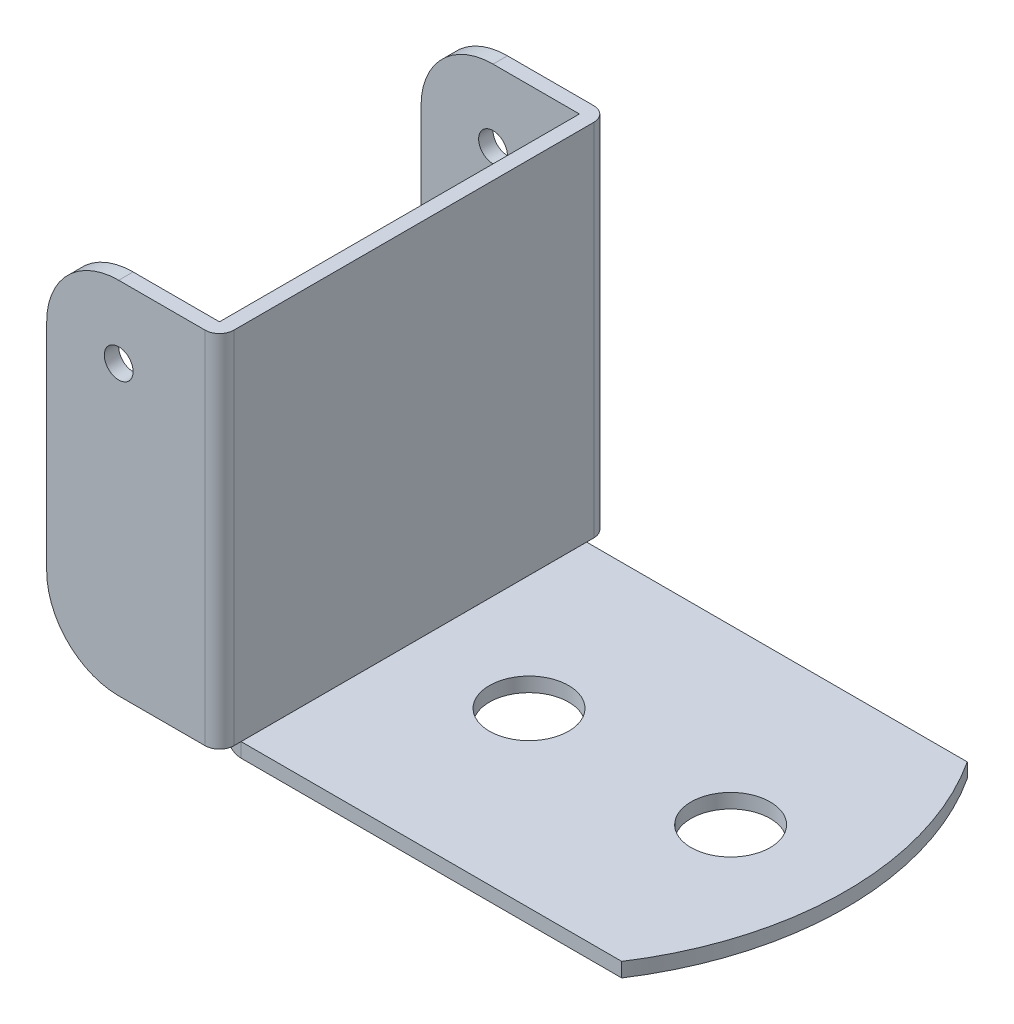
SolidWorks part; units mm, degrees
ref_plane "Front Plane" through (0, 0, 0) normal (0, 0, 1) x (1, 0, 0)
ref_plane "Top Plane" through (0, 0, 0) normal (0, 1, 0) x (1, 0, 0)
ref_plane "Right Plane" through (0, 0, 0) normal (1, 0, 0) x (0, 0, -1)
sketch "Sketch1" plane through (0, 0, 0) normal (0, 1, 0) x (1, 0, 0)
  line L0 (0, 0) -> (0, 24) construction
  line L1 (0, 0) -> (26.4391, 0)
  line L2 (0, 24) -> (26.4391, 24)
  line L3 (0, 12) -> (30, 12) construction
  line L4 (-25, 0) -> (-25, 24)
  line L5 (0, 24) -> (-25, 24)
  line L6 (0, 0) -> (-25, 0)
  circle A0 centre (8, 12) radius 2.75
  circle A1 centre (22, 12) radius 2.75
  arc A2 (26.4391, 0) -> (26.4391, 24) centre (8, 12) ccw
  point P17 (-25, 36)
  dimension "D1" = 5.5
  dimension "D2" = 22
  dimension "D3" = 14
  dimension "D4" = 8
  dimension "D5" = 24
  dimension "D7" = 12
  dimension "D6" = 25
sheet metal parameters "Sheet-Metal1" thickness 1 parameters "D1"=0.0001
base flange "Base-Flange1" sketch "Sketch1" thickness 1 reverse thickness direction yes parameters "D1"=0.0001
sketch "Sketch3" plane through (0, 1, 0) normal (0, 1, 0) x (1, 0, 0)
  line L1 (0, 0) -> (0, 24)
  line L2 (26.4391, 24) -> (-25, 24) construction
sketched bend "Sketched Bend16" parameters "D1"=0.001
bend "SketchBend39" bend radius 0.001 bend angle 90 parameters "D5"=1
ref_plane "Plane1" through (0, 0, -12) normal (0, 0, 1) x (1, 0, 0)
sketch "Sketch7" plane through (0, 0, 0) normal (0, 0, 1) x (1, 0, 0)
  line L1 (0, 26.0004) -> (-1, 26.0004)
  line L2 (0, 26.0004) -> (0, 1.0004)
  line L3 (0, 1.0004) -> (-1, 1.0004)
  line L4 (-1, 26.0004) -> (-1, 1.0004)
  dimension "D1" = 1
  dimension "D2" = 25
extrude "Extrude2" add sketch "Sketch7" along normal blind 0.5
sketch "Sketch8" plane through (0, 0, 0.5) normal (0, 0, 1) x (1, 0, 0)
  line L1 (0, 26.0004) -> (-7, 26.0004)
  line L2 (0, 26.0004) -> (0, 1.0004)
  line L3 (0, 1.0004) -> (-7, 1.0004)
  line L4 (-12, 21.0004) -> (-12, 6.0004)
  arc A0 (-12, 21.0004) -> (-7, 26.0004) centre (-7, 21.0004) cw
  arc A1 (-7, 1.0004) -> (-12, 6.0004) centre (-7, 6.0004) cw
  circle A2 centre (-7, 21.0004) radius 1
  point P7 (-12, 26.0004)
  point P10 (-12, 1.0004)
  dimension "D3" = 5
  dimension "D4" = 2
  dimension "D1" = 25
  dimension "D2" = 12
extrude "Extrude3" add sketch "Sketch8" along normal blind 1
fillet "Fillet2" radius 1 1 edges at (0, 13.5004, 1.5)
sketch "Sketch9" plane through (0, 0, -24) normal (0, 0, -1) x (-1, 0, 0)
  line L1 (0, 26.0004) -> (1, 26.0004)
  line L2 (0, 26.0004) -> (0, 1.0004)
  line L3 (0, 1.0004) -> (1, 1.0004)
  line L4 (1, 26.0004) -> (1, 1.0004)
  dimension "D1" = 25
  dimension "D2" = 1
extrude "Extrude4" add sketch "Sketch9" along normal blind 0.5
mirror "Mirror3" about plane through (0, 0, -12) normal (0, 0, 1) of "Fillet2", "Extrude3"
flat pattern "Flat-Pattern1"
sketch "Bend-Lines1" plane through (0, 0, 0) normal (0, 1, 0) x (-1, 0, 0)
bend of the flat pattern "Flatten-<SketchBend39>1"
